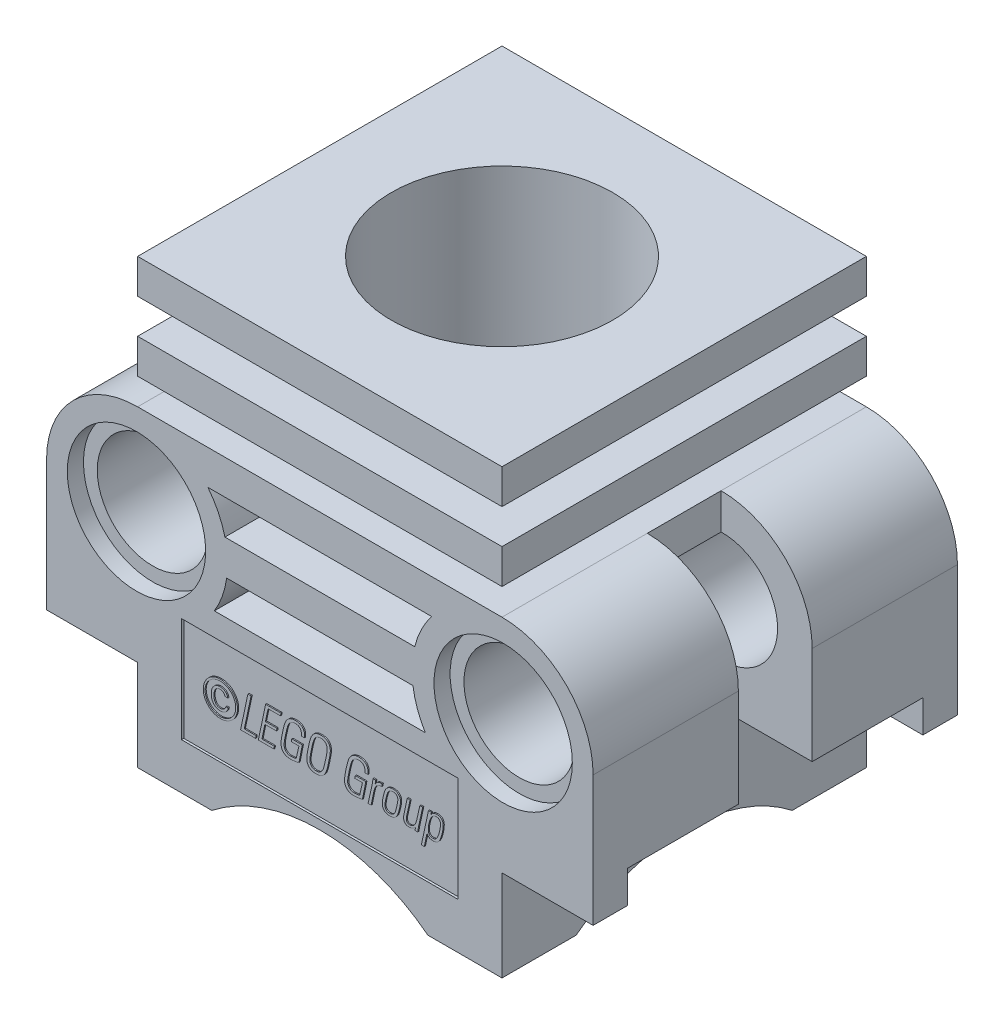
SolidWorks part; units mm, degrees
ref_plane "Plano1" through (0, 0, 0) normal (0, 0, 1) x (1, 0, 0)
ref_plane "Plano2" through (0, 0, 0) normal (0, 1, 0) x (1, 0, 0)
ref_plane "Plano3" through (0, 0, 0) normal (1, 0, 0) x (0, 0, -1)
sketch "Sketch1" plane through (0, 0, 0) normal (0, 0, 1) x (1, 0, 0)
  line L0 (-7.9, 0) -> (7.9, 0)
  line L1 (0, 0) -> (0, 5.7963) construction
  line L2 (7.9, 0) -> (7.9, 3.95)
  line L3 (7.9, 3.95) -> (11.85, 3.95)
  line L4 (11.85, 3.95) -> (11.85, 9.6)
  line L5 (7.9, 13.55) -> (-7.9, 13.55)
  line L6 (-11.85, 3.95) -> (-11.85, 9.6)
  line L7 (-7.9, 3.95) -> (-11.85, 3.95)
  line L8 (-7.9, 0) -> (-7.9, 3.95)
  arc A0 (7.9, 13.55) -> (11.85, 9.6) centre (7.9, 9.6) cw
  arc A1 (-7.9, 13.55) -> (-11.85, 9.6) centre (-7.9, 9.6) ccw
  point P11 (11.85, 13.55)
  point P15 (0, 13.55)
  dimension "D6" = 3.95
  dimension "D1" = 15.8
  dimension "D3" = 3.95
  dimension "D4" = 3.95
  dimension "D5" = 9.6
extrude "Base-Extrude" add sketch "Sketch1" along normal mid plane 15.8
sketch "Sketch2" plane through (0, 0, 0) normal (0, -1, 0) x (1, 0, 0)
  line L2 (-7.9, 6.4) -> (7.9, 6.4)
  line L3 (-6.4, 6.4) -> (6.4, 6.4)
  line L5 (6.4, 7.9) -> (6.4, -7.9)
  line L6 (6.4, 6.4) -> (6.4, -6.4)
  line L8 (-7.9, -6.4) -> (7.9, -6.4)
  line L9 (-6.4, -6.4) -> (6.4, -6.4)
  line L10 (7.9, 7.9) -> (7.9, -7.9) construction
  line L11 (-6.4, 7.9) -> (-6.4, -7.9)
  line L12 (-6.4, 6.4) -> (-6.4, -6.4)
  line L13 (7.9, 6.4) -> (7.9, -6.4)
  line L14 (7.9, 6.4) -> (14.3774, 6.4)
  line L15 (7.9, -6.4) -> (14.3774, -6.4)
  line L16 (14.3774, -6.4) -> (14.3774, 6.4)
  dimension "D1" = 1.5
  dimension "D2" = 1.5
  dimension "D3" = 1.5
  dimension "D4" = 1.5
extrude "Cut-Extrude1" cut sketch "Sketch2" against normal blind 5.35
sketch "Sketch3" plane through (0, 5.35, 0) normal (0, -1, 0) x (1, 0, 0)
  line L0 (7.9, 7.9) -> (7.9, -7.9) construction
  line L1 (7.9, 1.6) -> (7.9, -1.6)
  line L2 (7.9, 1.6) -> (12.9422, 1.6)
  line L4 (0, 0) -> (12.9422, 0) construction
  line L5 (7.9, -1.6) -> (12.9422, -1.6)
  line L6 (12.9422, 1.6) -> (12.9422, -1.6)
  dimension "D1" = 1.6
extrude "Cut-Extrude2" cut sketch "Sketch3" against normal through all
mirror "Mirror1" about plane through (0, 0, 0) normal (1, 0, 0) of "Cut-Extrude2", "Cut-Extrude1"
sketch "Sketch4" plane through (0, 0, 7.9) normal (0, 0, 1) x (1, 0, 0)
  line L0 (0, 0) -> (0, 16.5161) construction
  line L1 (7.9, 13.55) -> (-7.9, 13.55) construction
  line L2 (-4.8516, 12.05) -> (4.8516, 12.05)
  line L4 (-4.1159, 10.55) -> (4.1159, 10.55)
  line L6 (-4.0385, 9.05) -> (4.0385, 9.05)
  line L8 (-4.5736, 7.55) -> (4.5736, 7.55)
  arc A0 (4.0385, 9.05) -> (4.5736, 7.55) centre (7.95, 9.6) ccw
  arc A1 (4.8516, 12.05) -> (4.1159, 10.55) centre (7.95, 9.6) ccw
  arc A2 (-4.8516, 12.05) -> (-4.1159, 10.55) centre (-7.95, 9.6) cw
  arc A3 (-4.0385, 9.05) -> (-4.5736, 7.55) centre (-7.95, 9.6) cw
  point P4 (0, 12.05)
  point P6 (0, 9.05)
  point P12 (0, 10.55)
  point P19 (0, 7.55)
  dimension "D5" = 3.95
  dimension "D6" = 7.9
  dimension "D2" = 1.5
  dimension "D3" = 1.5
  dimension "D4" = 7.95
extrude "Cut-Extrude3" cut sketch "Sketch4" against normal through all
sketch "Sketch5" plane through (0, 0, 0) normal (0, -1, 0) x (1, 0, 0)
  circle A0 centre (0, 0) radius 6.3
  dimension "D1" = 12.6
extrude "Boss-Extrude1" add sketch "Sketch5" against normal blind 19.2
sketch "Sketch6" plane through (0, 19.2, 0) normal (0, 1, 0) x (-1, 0, 0)
  line L0 (-7.9, 7.9) -> (-7.9, 1.6) construction
  line L1 (-7.9, 7.9) -> (-7.9, -7.9)
  line L2 (-7.9, 7.9) -> (7.9, 7.9) construction
  line L3 (-7.9, 7.9) -> (7.9, 7.9)
  line L4 (-7.9, -7.9) -> (7.9, -7.9) construction
  line L5 (-7.9, -7.9) -> (7.9, -7.9)
  line L6 (7.9, 7.9) -> (7.9, 1.6) construction
  line L7 (7.9, 7.9) -> (7.9, -7.9)
extrude "Boss-Extrude2" add sketch "Sketch6" against normal blind 1.5
pattern_linear "LPattern2" count 2 spacing 3 along (0, -1, 0) of "Boss-Extrude2"
sketch "Sketch8" plane through (0, 0, 0) normal (0, -1, 0) x (1, 0, 0)
  circle A0 centre (0, 0) radius 4.8
  circle A1 centre (0, 0) radius 6.3 construction
  dimension "D1" = 9.6
extrude "Cut-Extrude4" cut sketch "Sketch8" against normal through all
sketch "Sketch9" plane through (0, 0, 7.9) normal (0, 0, 1) x (1, 0, 0)
  line L0 (0, 0) -> (0, 20.7269) construction
  line L1 (0, 9.05) -> (0, 7.55) construction
  line L2 (7.9, 13.55) -> (-7.9, 13.55) construction
  circle A0 centre (7.95, 9.6) radius 3
  circle A1 centre (-7.95, 9.6) radius 3
  dimension "D3" = 6
  dimension "D1" = 7.95
  dimension "D2" = 3.95
extrude "Cut-Extrude5" cut sketch "Sketch9" against normal blind 0.7
mirror "Mirror2" about plane through (0, 0, 0) normal (0, 0, 1) of "Cut-Extrude5"
sketch "Sketch10" plane through (0, 0, 7.2) normal (0, 0, 1) x (1, 0, 0)
  line L0 (0, 0) -> (0, 13.0008) construction
  line L1 (0, 9.05) -> (0, 7.55) construction
  circle A0 centre (7.95, 9.6) radius 2.4
  circle A1 centre (7.95, 9.6) radius 3 construction
  circle A2 centre (-7.95, 9.6) radius 2.4
  dimension "D1" = 4.8
extrude "Cut-Extrude6" cut sketch "Sketch10" against normal through all
sketch "Sketch12" plane through (0, 0, 0) normal (0, 0, 1) x (1, 0, 0)
  line L0 (0, 9.05) -> (0, 7.55) construction
  circle A0 centre (0, -6.0079) radius 7.62
  dimension "D1" = 15.24
extrude "Cut-Extrude8" cut sketch "Sketch12" against normal through all and the other way through all
pattern_circular "CirPattern1" count 2 every 90 about axis through (0, 19.2, 0) along (0, -1, 0) of "Cut-Extrude8"
sketch "Sketch13" plane through (0, 0, 0) normal (0, -1, 0) x (1, 0, 0)
  line L0 (6.4, -6.4) -> (6.4, -4.6872) construction
  line L1 (6.4, -6.4) -> (6.4, -4.6872)
  line L2 (4.6872, -6.4) -> (6.4, -6.4) construction
  line L3 (-6.4, -6.4) -> (6.4, -6.4)
  line L4 (-6.4, -4.6872) -> (-6.4, -6.4) construction
  line L5 (-6.4, 6.4) -> (-6.4, -6.4)
  line L6 (-4.6872, 6.4) -> (-6.4, 6.4) construction
  line L7 (6.4, 6.4) -> (-6.4, 6.4)
  line L8 (6.4, 4.6872) -> (6.4, 6.4) construction
  line L9 (6.4, -4.6872) -> (6.4, 6.4)
extrude "Cut-Extrude9" cut sketch "Sketch13" against normal blind 2.5
sketch "Sketch14" plane through (0, 0, 7.9) normal (0, 0, 1) x (1, 0, 0)
  line L0 (-4.5736, 7.55) -> (4.5736, 7.55) construction
  line L1 (-6, 6.55) -> (6, 6.55)
  line L2 (-6, 6.55) -> (-6, 2)
  line L3 (-6, 2) -> (6, 2)
  line L4 (6, 6.55) -> (6, 2)
  line L5 (4.6872, 0) -> (7.9, 0) construction
  line L6 (0, 0) -> (0, 14.3009) construction
  line L7 (0, 5.35) -> (0, 2.5) construction
  dimension "D1" = 1
  dimension "D2" = 2
  dimension "D3" = 12
  dimension "D4" = 6
extrude "Cut-Extrude10" cut sketch "Sketch14" against normal blind 0.1
sketch "Sketch15" plane through (0, 0, 7.8) normal (0, 0, 1) x (1, 0, 0)
  text T0 "©LEGO Group" font "Zurich LtCn BT" height in points 6
extrude "Boss-Extrude4" add sketch "Sketch15" along normal blind 0.05
pattern_circular "CirPattern2" count 2 every 180 of "Cut-Extrude10", "Boss-Extrude4"
sketch "Sketch16" plane through (0, 2.5, 0) normal (0, -1, 0) x (1, 0, 0)
  line L0 (0, 0) -> (0, 6.8255) construction
  line L1 (0, 6.4) -> (0, 7.9) construction
  line L2 (0, 0) -> (7.7295, 0) construction
  line L3 (7.9, 0) -> (6.4, 0) construction
  line L4 (-0.75, 6.4) -> (-0.75, 6.2552)
  line L5 (0.75, 6.4) -> (0.75, 6.2552)
  line L6 (-6.4, 0.75) -> (-6.2552, 0.75)
  line L7 (-6.4, -0.75) -> (-6.2552, -0.75)
  line L8 (6.4, 4.6872) -> (6.4, -4.6872) construction
  line L9 (6.4, 0.75) -> (6.4, -0.75)
  line L10 (-4.6872, 6.4) -> (4.6872, 6.4) construction
  line L11 (-0.75, 6.4) -> (0.75, 6.4)
  line L12 (-6.4, -4.6872) -> (-6.4, 4.6872) construction
  line L13 (-6.4, -0.75) -> (-6.4, 0.75)
  line L14 (4.6872, -6.4) -> (-4.6872, -6.4) construction
  line L15 (0.75, -6.4) -> (-0.75, -6.4)
  line L16 (-0.75, -6.2552) -> (-0.75, -6.4)
  line L17 (0.75, -6.2552) -> (0.75, -6.4)
  line L18 (6.2552, -0.75) -> (6.4, -0.75)
  line L19 (6.2552, 0.75) -> (6.4, 0.75)
  circle A0 centre (0, 0) radius 6.3 construction
  arc A1 (-0.75, -6.2552) -> (0.75, -6.2552) centre (0, 0) ccw
  arc A2 (6.2552, -0.75) -> (6.2552, 0.75) centre (0, 0) ccw
  arc A3 (0.75, 6.2552) -> (-0.75, 6.2552) centre (0, 0) ccw
  arc A4 (-6.2552, 0.75) -> (-6.2552, -0.75) centre (0, 0) ccw
  dimension "D1" = 0.75
  dimension "D2" = 0.75
extrude "Boss-Extrude5" add sketch "Sketch16" along normal up to surface (2.85 mm away)
